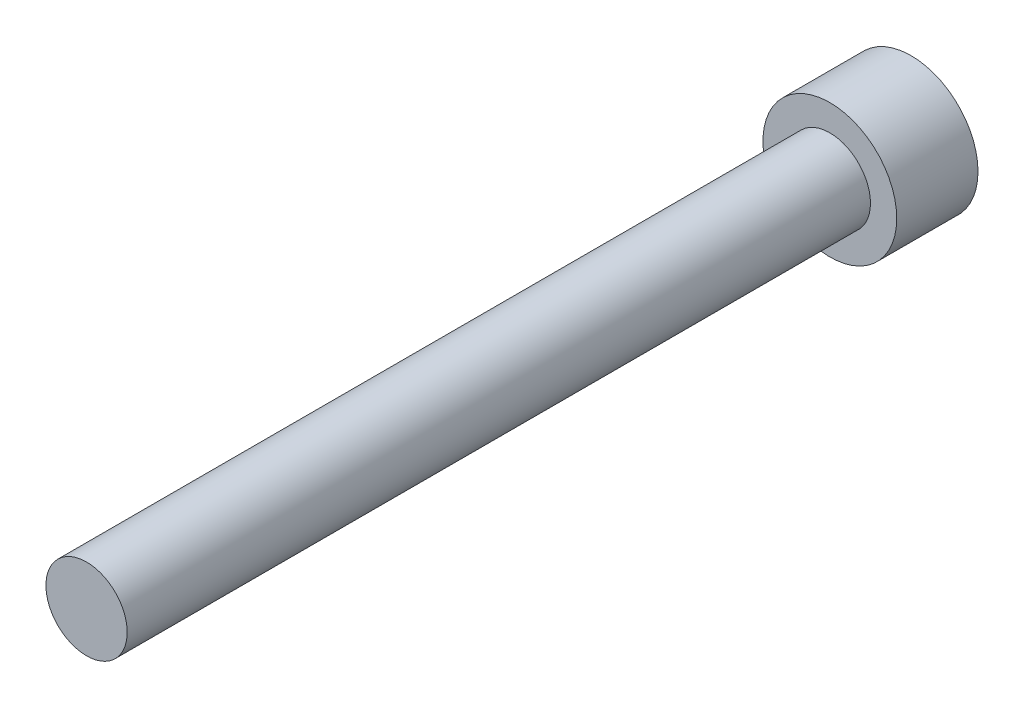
SolidWorks part; units mm, degrees
ref_plane "Front Plane" through (0, 0, 0) normal (0, 0, 1) x (1, 0, 0)
ref_plane "Top Plane" through (0, 0, 0) normal (0, 1, 0) x (1, 0, 0)
ref_plane "Right Plane" through (0, 0, 0) normal (1, 0, 0) x (0, 0, -1)
sketch "Sketch6" plane through (0, 0, 0) normal (1, 0, 0) x (0, 0, -1)
  line L0 (-38.1, 0) -> (22.525, 0) construction
  line L1 (3.7719, 0) -> (-3.7719, 0) construction
  line L2 (-38.1, 0) -> (-38.1, -2.0828)
  line L3 (-38.1, -2.0828) -> (0, -2.0828)
  line L4 (0, 3.7719) -> (0, -3.7719) construction
  line L5 (0, -2.0828) -> (0, -3.429)
  line L6 (0, -3.429) -> (4.1656, -3.429)
  line L7 (4.1656, -3.429) -> (4.1656, 0)
  line L8 (4.1656, 0) -> (-38.1, 0)
  dimension "L" = 38.1
  dimension "H" = 4.1656
  dimension "A" = 6.858
  dimension "D" = 4.1656
revolve "Revolve1" add sketch "Sketch6" angle 360 about L0
sketch "Sketch7" plane through (0, 0, -4.1656) normal (0, 0, -1) x (-1, 0, 0)
  line L2 (-1.778, 1.0265) -> (-1.778, -1.0265)
  line L4 (-1.778, -1.0265) -> (0, -2.0531)
  line L5 (0, -2.0531) -> (1.778, -1.0265)
  line L6 (1.778, -1.0265) -> (1.778, 1.0265)
  line L7 (1.778, 1.0265) -> (0, 2.0531)
  line L8 (0, 2.0531) -> (-1.778, 1.0265)
  circle A0 centre (0, 0) radius 1.778 construction
  dimension "J" = 3.556
extrude "HEX" cut sketch "Sketch7" against normal blind 2.794
